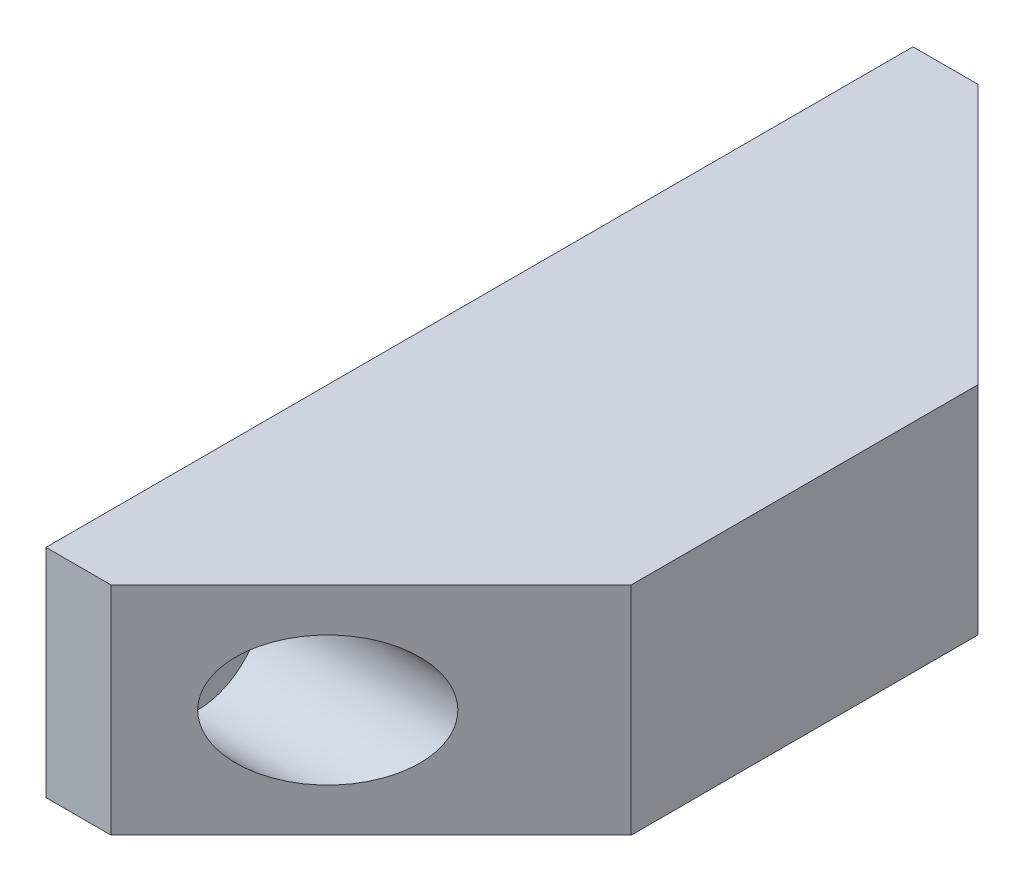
SolidWorks part; units mm, degrees
ref_plane "Plan1" through (0, 0, 0) normal (0, 0, 1) x (1, 0, 0)
ref_plane "Plan2" through (0, 0, 0) normal (0, 1, 0) x (1, 0, 0)
ref_plane "Plan3" through (0, 0, 0) normal (1, 0, 0) x (0, 0, -1)
sketch "Esquisse1" plane through (0, 0, 0) normal (0, 1, 0) x (1, 0, 0)
  line L0 (-4.4849, 0) -> (26.6034, 0) construction
  line L1 (0, 20) -> (3, 20)
  line L2 (0, 20) -> (0, -20)
  line L3 (0, -20) -> (3, -20)
  line L4 (15, 8) -> (15, -8)
  line L5 (-5.5, 0) -> (5.5, 0) construction
  line L6 (3, 20) -> (15, 8)
  line L9 (15, -8) -> (3, -20)
  dimension "D1" = 15
  dimension "D2" = 3
  dimension "D3" = 45
  dimension "D7" = 40
extrude "Boss.-Extru.1" add sketch "Esquisse1" along normal mid plane 10
sketch "Esquisse2" plane through (0, 0, 0) normal (0, 1, 0) x (1, 0, 0)
  line L0 (-9.2092, 15) -> (21.5094, 15) construction
  line L1 (-5.5, 0) -> (5.5, 0) construction
  line L2 (0, 15) -> (0, 13.45)
  line L3 (0, 13.45) -> (2, 13.45)
  line L4 (2, 13.45) -> (2, 12)
  line L5 (2, 12) -> (15, 12)
  line L6 (15, 12) -> (15, 15)
  line L7 (15, 15) -> (0, 15)
  line L8 (0, 20) -> (0, -20) construction
  line L9 (15, -8) -> (15, 8) construction
  dimension "D1" = 15
  dimension "D2" = 3.1
  dimension "D3" = 2
  dimension "D4" = 6
revolve "Enlèvement de matière-Révolution1" cut sketch "Esquisse2" angle 360 about L0
mirror "Symétrie1" about plane through (0, 0, 0) normal (0, 0, 1) of "Enlèvement de matière-Révolution1"
